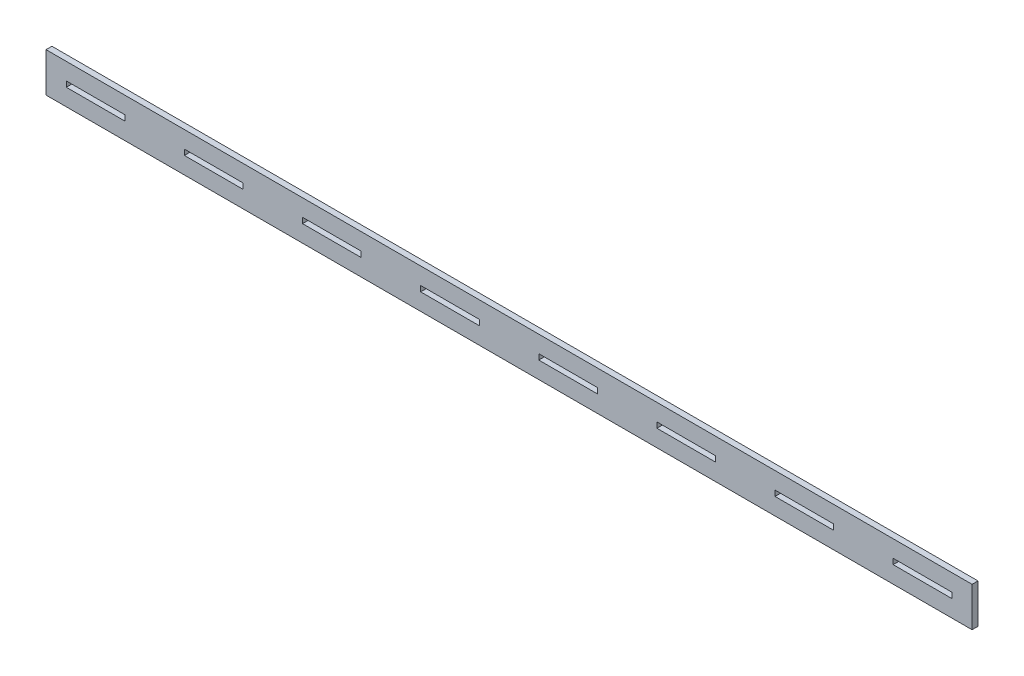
SolidWorks part; units mm, degrees
ref_plane "Alzado" through (0, 0, 0) normal (0, 0, 1) x (1, 0, 0)
ref_plane "Planta" through (0, 0, 0) normal (0, 1, 0) x (1, 0, 0)
ref_plane "Vista lateral" through (0, 0, 0) normal (1, 0, 0) x (0, 0, -1)
sketch "Croquis1" plane through (0, 0, 0) normal (0, 0, 1) x (1, 0, 0)
  line L0 (-235.2, 0) -> (235.2, 0) construction
  line L1 (-235.2, -10) -> (235.2, -10)
  line L2 (-235.2, -10) -> (-235.2, 10)
  line L3 (-235.2, 10) -> (235.2, 10)
  line L4 (235.2, -10) -> (235.2, 10)
  line L5 (-235.2, -10) -> (235.2, 10) construction
  line L6 (-235.2, 10) -> (235.2, -10) construction
  line L8 (-224.9, -1.4) -> (-195.1, -1.4)
  line L9 (-224.9, -1.4) -> (-224.9, 1.4)
  line L10 (-224.9, 1.4) -> (-195.1, 1.4)
  line L11 (-195.1, -1.4) -> (-195.1, 1.4)
  line L12 (-224.9, -1.4) -> (-195.1, 1.4) construction
  line L13 (-224.9, 1.4) -> (-195.1, -1.4) construction
  line L14 (-44.9, -1.4) -> (-15.1, -1.4)
  line L15 (-44.9, -1.4) -> (-44.9, 1.4)
  line L16 (-44.9, 1.4) -> (-15.1, 1.4)
  line L17 (-15.1, -1.4) -> (-15.1, 1.4)
  line L18 (-44.9, -1.4) -> (-15.1, 1.4) construction
  line L19 (-44.9, 1.4) -> (-15.1, -1.4) construction
  line L20 (-104.9, -1.4) -> (-75.1, -1.4)
  line L21 (-104.9, -1.4) -> (-104.9, 1.4)
  line L22 (-104.9, 1.4) -> (-75.1, 1.4)
  line L23 (-75.1, -1.4) -> (-75.1, 1.4)
  line L24 (-104.9, -1.4) -> (-75.1, 1.4) construction
  line L25 (-104.9, 1.4) -> (-75.1, -1.4) construction
  line L26 (-164.9, -1.4) -> (-135.1, -1.4)
  line L27 (-164.9, -1.4) -> (-164.9, 1.4)
  line L28 (-164.9, 1.4) -> (-135.1, 1.4)
  line L29 (-135.1, -1.4) -> (-135.1, 1.4)
  line L30 (-164.9, -1.4) -> (-135.1, 1.4) construction
  line L31 (-164.9, 1.4) -> (-135.1, -1.4) construction
  line L32 (15.1, -1.4) -> (44.9, -1.4)
  line L33 (15.1, -1.4) -> (15.1, 1.4)
  line L34 (15.1, 1.4) -> (44.9, 1.4)
  line L35 (44.9, -1.4) -> (44.9, 1.4)
  line L36 (15.1, -1.4) -> (44.9, 1.4) construction
  line L37 (15.1, 1.4) -> (44.9, -1.4) construction
  line L38 (75.1, -1.4) -> (104.9, -1.4)
  line L39 (75.1, -1.4) -> (75.1, 1.4)
  line L40 (75.1, 1.4) -> (104.9, 1.4)
  line L41 (104.9, -1.4) -> (104.9, 1.4)
  line L42 (75.1, -1.4) -> (104.9, 1.4) construction
  line L43 (75.1, 1.4) -> (104.9, -1.4) construction
  line L44 (135.1, -1.4) -> (164.9, -1.4)
  line L45 (135.1, -1.4) -> (135.1, 1.4)
  line L46 (135.1, 1.4) -> (164.9, 1.4)
  line L47 (164.9, -1.4) -> (164.9, 1.4)
  line L48 (135.1, -1.4) -> (164.9, 1.4) construction
  line L49 (135.1, 1.4) -> (164.9, -1.4) construction
  line L50 (195.1, -1.4) -> (224.9, -1.4)
  line L51 (195.1, -1.4) -> (195.1, 1.4)
  line L52 (195.1, 1.4) -> (224.9, 1.4)
  line L53 (224.9, -1.4) -> (224.9, 1.4)
  line L54 (195.1, -1.4) -> (224.9, 1.4) construction
  line L55 (195.1, 1.4) -> (224.9, -1.4) construction
  point P0 (0, 0)
  point P8 (0, 0)
  point P9 (-210, 0)
  point P13 (-30, 0)
  point P18 (-150, 0)
  point P19 (-90, 0)
  point P28 (30, 0)
  point P33 (90, 0)
  point P38 (150, 0)
  point P43 (210, 0)
  dimension "D1" = 470.4
  dimension "D2" = 20
  dimension "D3" = 2.8
  dimension "D4" = 30
  dimension "D5" = 29.8
  dimension "D6" = 29.8
  dimension "D7" = 60
  dimension "D8" = 29.8
  dimension "D9" = 60
  dimension "D10" = 29.8
  dimension "D11" = 2.8
  dimension "D12" = 2.8
  dimension "D13" = 30
  dimension "D14" = 29.8
  dimension "D15" = 2.8
  dimension "D16" = 60
  dimension "D17" = 29.8
  dimension "D18" = 2.8
  dimension "D19" = 60
  dimension "D20" = 29.8
  dimension "D21" = 2.8
  dimension "D22" = 60
  dimension "D23" = 2.8
  dimension "D24" = 29.8
  dimension "D25" = 2.8
  dimension "D26" = 60
extrude "Saliente-Extruir1" add sketch "Croquis1" along normal blind 3
